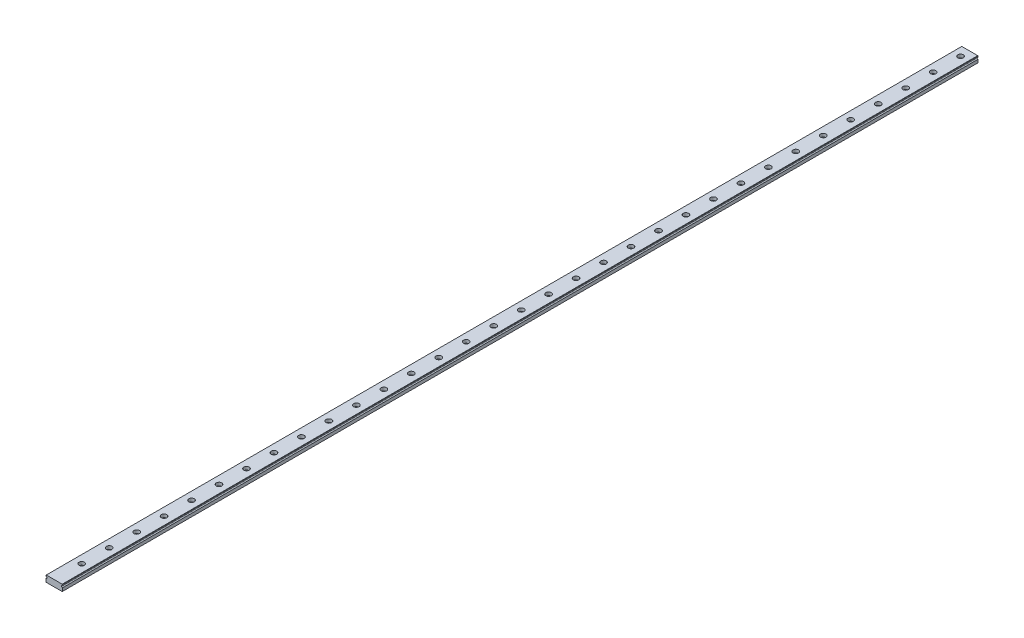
SolidWorks part; units mm, degrees
ref_plane "Front Plane" through (0, 0, 0) normal (0, 0, 1) x (1, 0, 0)
ref_plane "Top Plane" through (0, 0, 0) normal (0, 1, 0) x (1, 0, 0)
ref_plane "Right Plane" through (0, 0, 0) normal (1, 0, 0) x (0, 0, -1)
sketch "Sketch2" plane through (0, 0, 0) normal (0, 0, 1) x (1, 0, 0)
  line L0 (9.2645, 2.3272) -> (9.2645, 3.3272)
  line L1 (9.2645, 3.3272) -> (8.9645, 3.6272)
  line L2 (8.9645, 3.6272) -> (-8.4355, 3.6272)
  line L3 (-8.4355, 3.6272) -> (-8.7355, 3.3272)
  line L4 (-8.7355, 3.3272) -> (-8.7355, 2.3272)
  line L5 (-8.7355, 0.3272) -> (-8.7355, -3.0728)
  line L6 (-8.7355, -3.0728) -> (-8.4355, -3.3728)
  line L7 (-8.4355, -3.3728) -> (4.4645, -3.3728)
  line L8 (5.0645, -3.3728) -> (8.9645, -3.3728)
  line L9 (8.9645, -3.3728) -> (9.2645, -3.0728)
  line L10 (9.2645, -3.0728) -> (9.2645, 0.3272)
  line L11 (4.4645, -3.3728) -> (5.0645, -3.3728)
  arc A0 (8.2645, 1.3272) -> (9.2645, 0.3272) centre (9.2645, 1.3272) ccw
  arc A1 (9.2645, 2.3272) -> (8.2645, 1.3272) centre (9.2645, 1.3272) ccw
  arc A2 (-8.7355, 0.3272) -> (-8.7355, 2.3272) centre (-8.7355, 1.3272) ccw
extrude "Boss-Extrude1" add sketch "Sketch2" along normal blind 1000
sketch "Sketch3" plane through (0, 3.6272, 0) normal (0, 1, 0) x (1, 0, 0)
  line L0 (9.2645, -1000) -> (9.2645, 0) construction
  line L2 (8.9645, 0) -> (-8.4355, 0) construction
  point P0 (0.2645, -10)
  dimension "D1" = 9
  dimension "D2" = 10
hole_wizard "CBORE for M16 Hex Head Bolt1" positions "Sketch3" profile "Sketch4" counterbore size "M16" standard "DIN"
sketch "Sketch4" plane through (0.2645, 3.6272, 10) normal (1, 0, 0) x (0, 0, 1)
  line L0 (0, 0) -> (0, 7)
  line L1 (0, 7) -> (1.75, 7)
  line L3 (1.75, 7) -> (1.75, 3.5)
  line L4 (1.75, 3.5) -> (3, 3.5)
  line L5 (3, 3.5) -> (3, 0)
  line L7 (3, 0) -> (0, 0)
  line L11 (0, -6.35) -> (0, 107.95) construction
  dimension "Thru Hole Dia." = 3.5
  dimension "Thru Hole Depth" = 7
  dimension "C'Bore Dia." = 6
  dimension "C'Bore Depth" = 3.5
other "Fill Pattern1" parameters "D5"=0, "D6"=0, "D1"=30, "D2"=60, "D3"=0, "D9"=33, "D7"=34, "D8"=2
